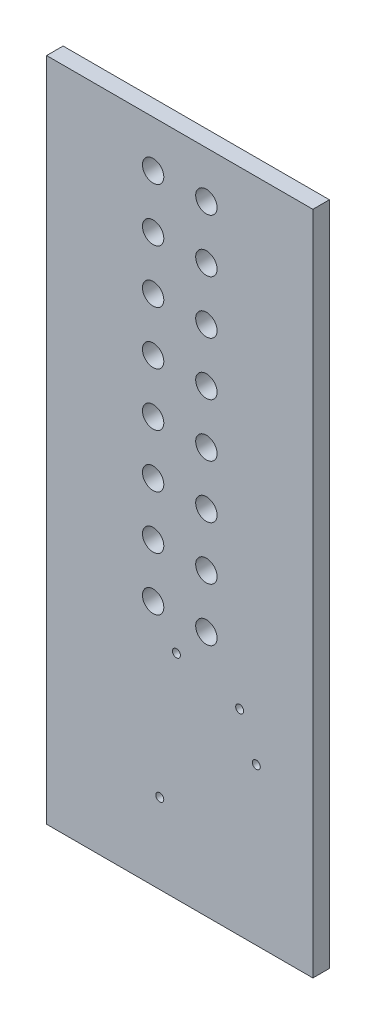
SolidWorks part; units mm, degrees
ref_plane "Front Plane" through (0, 0, 0) normal (0, 0, 1) x (1, 0, 0)
ref_plane "Top Plane" through (0, 0, 0) normal (0, 1, 0) x (1, 0, 0)
ref_plane "Right Plane" through (0, 0, 0) normal (1, 0, 0) x (0, 0, -1)
ref_plane "Dielectric_Layer Layer 1" through (0, 0, 0.7874) normal (0, 0, 1) x (1, 0, 0)
sketch "Sketch1" plane through (0, 0, 0) normal (0, 0, 1) x (1, 0, 0)
  line L0 (0, 0) -> (0, 31.75)
  line L1 (0, 31.75) -> (12.7, 31.75)
  line L2 (12.7, 31.75) -> (12.7, 0)
  line L3 (12.7, 0) -> (0, 0)
extrude "Board_Outline" add sketch "Sketch1" along normal blind 0.7874 separate body
sketch "Sketch2" plane through (0, 0, 0) normal (0, 0, 1) x (1, 0, 0)
  circle A0 centre (10.0013, 7.4613) radius 0.1905
  circle A1 centre (9.2075, 9.3663) radius 0.1905
  circle A2 centre (5.3975, 3.81) radius 0.1905
  circle A3 centre (6.1913, 10.16) radius 0.1905
extrude "NPTH" cut sketch "Sketch2" along normal through all
sketch "Sketch3" plane through (0, 0, 0) normal (0, 0, 1) x (1, 0, 0)
  circle A0 centre (7.62, 11.75) radius 0.51
  circle A1 centre (7.62, 14.29) radius 0.51
  circle A2 centre (7.62, 16.83) radius 0.51
  circle A3 centre (7.62, 19.37) radius 0.51
  circle A4 centre (7.62, 21.91) radius 0.51
  circle A5 centre (7.62, 24.45) radius 0.51
  circle A6 centre (7.62, 26.99) radius 0.51
  circle A7 centre (7.62, 29.53) radius 0.51
  circle A8 centre (5.08, 11.75) radius 0.51
  circle A9 centre (5.08, 14.29) radius 0.51
  circle A10 centre (5.08, 16.83) radius 0.51
  circle A11 centre (5.08, 19.37) radius 0.51
  circle A12 centre (5.08, 21.91) radius 0.51
  circle A13 centre (5.08, 24.45) radius 0.51
  circle A14 centre (5.08, 26.99) radius 0.51
  circle A15 centre (5.08, 29.53) radius 0.51
extrude "PTH" cut sketch "Sketch3" along normal through all
